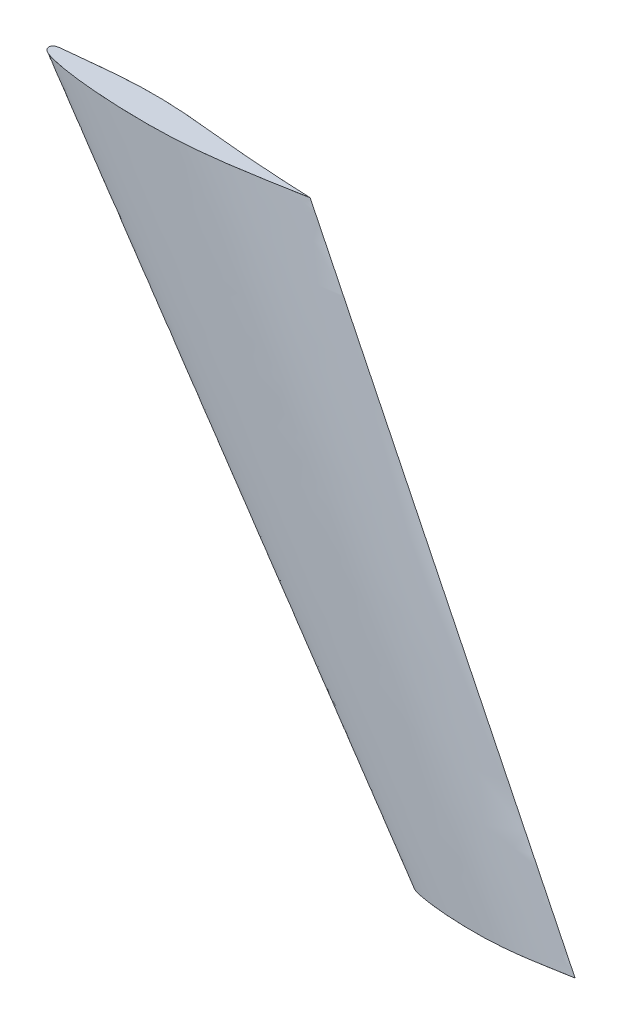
SolidWorks part; units mm, degrees
ref_plane "Ebene vorne" through (0, 0, 0) normal (0, 0, 1) x (1, 0, 0)
ref_plane "Ebene oben" through (0, 0, 0) normal (0, 1, 0) x (1, 0, 0)
ref_plane "Ebene rechts" through (0, 0, 0) normal (1, 0, 0) x (0, 0, -1)
curve "Kurve2"
curve "Kurve3"
surface "Oberfläche-Ebene1"
surface "Oberfläche-Ebene2"
sketch3d "3D-Skizze1"
  line L0 (162.3603, -168, -0.0098) -> (212.1089, -270, -0.0059)
  point P0 (162.3603, -168, -0.0098)
  point P1 (162.3605, -168, -0.0083)
surface "Oberfläche-Ausformung1"
